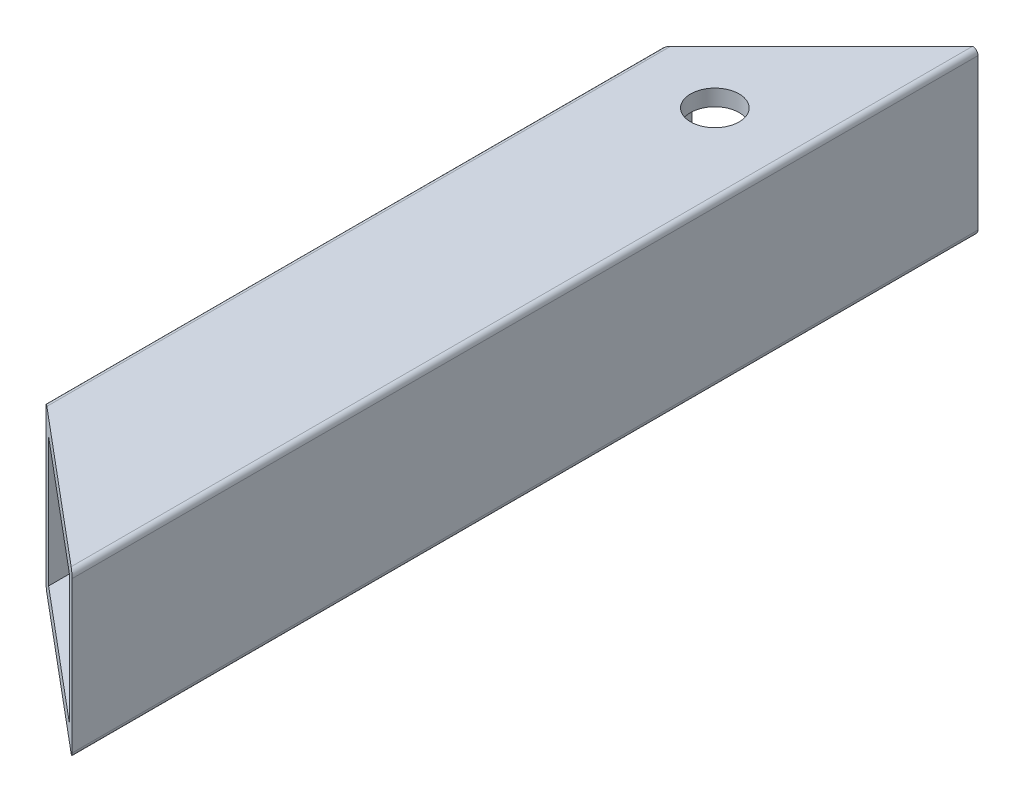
SolidWorks part; units mm, degrees
ref_plane "Plan1" through (0, 0, 0) normal (0, 0, 1) x (1, 0, 0)
ref_plane "Plan2" through (0, 0, 0) normal (0, 1, 0) x (1, 0, 0)
ref_plane "Plan3" through (0, 0, 0) normal (1, 0, 0) x (0, 0, -1)
sketch "Esquisse1" plane through (0, 0, 0) normal (0, 0, 1) x (1, 0, 0)
  line L0 (-14, 15) -> (14, 15)
  line L1 (-15, 14) -> (-15, -14)
  line L2 (14, -15) -> (-14, -15)
  line L3 (15, -14) -> (15, 14)
  line L4 (14, 14) -> (-14, -14) construction
  arc A0 (-14, -15) -> (-15, -14) centre (-14, -14) cw
  arc A1 (-15, 14) -> (-14, 15) centre (-14, 14) cw
  arc A2 (15, 14) -> (14, 15) centre (14, 14) ccw
  arc A3 (15, -14) -> (14, -15) centre (14, -14) cw
  dimension "D1" = 1
  dimension "D2" = 30
extrude "Base-Extru.-Mince" add sketch "Esquisse1" along normal blind 168 thin
sketch "Esquisse2" plane through (0, -15, 0) normal (0, -1, 0) x (1, 0, 0)
  line L0 (19.1146, 171.4526) -> (-42.5463, 119.7129)
  line L1 (14, 168) -> (-14, 168) construction
  line L2 (15, 0) -> (12.9995, -9.4935)
  line L3 (15, 168) -> (15, 0) construction
  line L4 (14, 0) -> (-14, 0) construction
  line L5 (-38.4019, 52.4019) -> (14, 0)
  line L7 (14, 0) -> (15, 0)
  circle A0 centre (0, 33.799) radius 4.5
  spline_without_curve S0
  spline_without_curve S1
  dimension "D2" = 9
  dimension "D1" = 40
  dimension "D3" = 1
  dimension "D4" = 14
  dimension "D5" = 15
  dimension "D6" = 45
extrude "Enlèv. mat.-Extru.1" cut sketch "Esquisse2" against normal through all
sketch "Esquisse3" [suppressed] plane through (15, 0, 0) normal (-1, 0, 0) x (0, 0, 1)
  line L2 (0, -14) -> (0, 14) construction
  circle A0 centre (5, 0) radius 1.5
  dimension "D1" = 3
  dimension "D2" = 5
